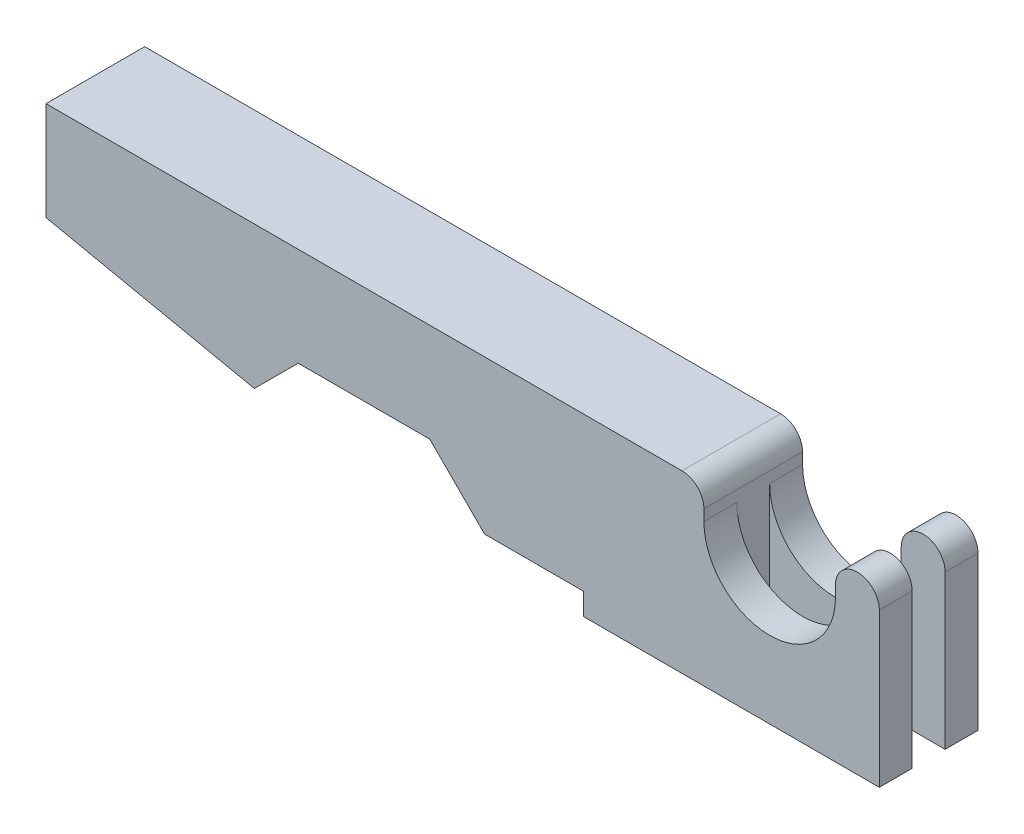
SolidWorks part; units mm, degrees
ref_plane "Plan de face" through (0, 0, 0) normal (0, 0, 1) x (1, 0, 0)
ref_plane "Plan de dessus" through (0, 0, 0) normal (0, 1, 0) x (1, 0, 0)
ref_plane "Plan de droite" through (0, 0, 0) normal (1, 0, 0) x (0, 0, -1)
sketch "Esquisse1" plane through (0, 0, 0) normal (0, 0, 1) x (1, 0, 0)
  line L0 (0, 0) -> (0, 7)
  line L1 (-8, 8) -> (-38, 8)
  line L2 (-38, 8) -> (-38, 3.5)
  line L3 (-38, 3.5) -> (-28.5, 1.5)
  line L4 (-28.5, 1.5) -> (-26.5, 3.5)
  line L5 (-26.5, 3.5) -> (-20.5, 3.5)
  line L6 (-20.5, 3.5) -> (-18, 1)
  line L7 (-18, 1) -> (-13.5, 1)
  line L8 (-13.5, 1) -> (-13.5, 0)
  line L9 (-13.5, 0) -> (0, 0)
  line L10 (-8, 8) -> (-8, 6.5)
  line L11 (-2, 7) -> (-2, 6.5)
  line L12 (-5, 10.3337) -> (-5, -1.3281) construction
  arc A0 (0, 7) -> (-2, 7) centre (-1, 7) ccw
  arc A1 (-8, 6.5) -> (-2, 6.5) centre (-5, 6.5) ccw
  dimension "D2" = 1
  dimension "D12" = 3
  dimension "D1" = 8
  dimension "D3" = 4.5
  dimension "D4" = 38
  dimension "D5" = 13.5
  dimension "D6" = 4.5
  dimension "D7" = 1
  dimension "D8" = 6
  dimension "D9" = 9.5
  dimension "D10" = 45
  dimension "D11" = 45
extrude "Boss.-Extru.1" add sketch "Esquisse1" along normal mid plane 4.5
sketch "Esquisse2" plane through (0, 0, 0) normal (0, -1, 0) x (1, 0, 0)
  line L0 (0, 2.25) -> (0, -2.25) construction
  line L1 (0, 0.75) -> (-8, 0.75)
  line L2 (0, 0.75) -> (0, -0.75)
  line L3 (0, -0.75) -> (-8, -0.75)
  line L4 (-8, 0.75) -> (-8, -0.75)
  line L5 (0, 0) -> (-10.5248, 0) construction
  dimension "D1" = 8
  dimension "D2" = 1.5
extrude "Enlèv. mat.-Extru.1" cut sketch "Esquisse2" against normal through all
fillet "Congé1" radius 1 1 edges at (-8, 8, 0)
